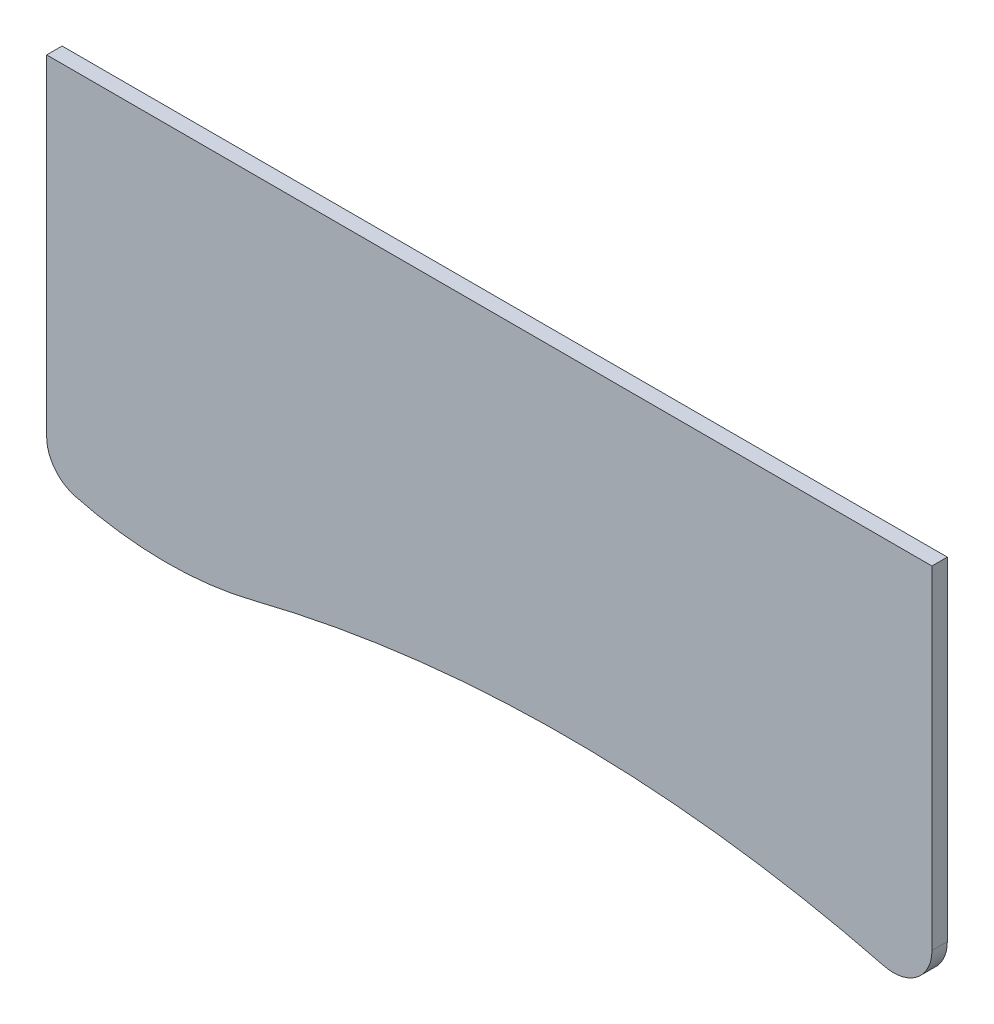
SolidWorks part; units mm, degrees
ref_plane "Front Plane" through (0, 0, 0) normal (0, 0, 1) x (1, 0, 0)
ref_plane "Top Plane" through (0, 0, 0) normal (0, 1, 0) x (1, 0, 0)
ref_plane "Right Plane" through (0, 0, 0) normal (1, 0, 0) x (0, 0, -1)
sketch "Sketch1" plane through (0, 0, 0) normal (0, 0, 1) x (1, 0, 0)
  line L1 (0, 0) -> (690, 0)
  line L2 (0, 0) -> (0, 300)
  line L3 (0, 300) -> (690, 300)
  line L4 (690, 0) -> (690, 300)
  dimension "D1" = 690
  dimension "D2" = 300
extrude "Boss-Extrude1" add sketch "Sketch1" against normal blind 12
sketch "Sketch2" plane through (0, 0, 0) normal (0, 0, 1) x (1, 0, 0)
  line L1 (0, 300) -> (0, 0) construction
  line L2 (0, 20.0368) -> (0, -175.0724)
  line L3 (0, -175.0724) -> (858.0149, -175.0724)
  line L4 (858.0149, -175.0724) -> (858.0149, -66.0146)
  arc A1 (858.0149, -66.0146) -> (161.2038, 12.3373) centre (404.9627, -957.4986) ccw
  arc A2 (161.2038, 12.3373) -> (0, 20.0368) centre (93.3184, 282.4308) cw
  dimension "D1" = 1000
extrude "Cut-Extrude1" cut sketch "Sketch2" against normal through all
fillet "Fillet1" radius 30 1 edges at (690, 1.0179, -6)
fillet "Fillet2" radius 30 1 edges at (0, 20.0368, -6)
